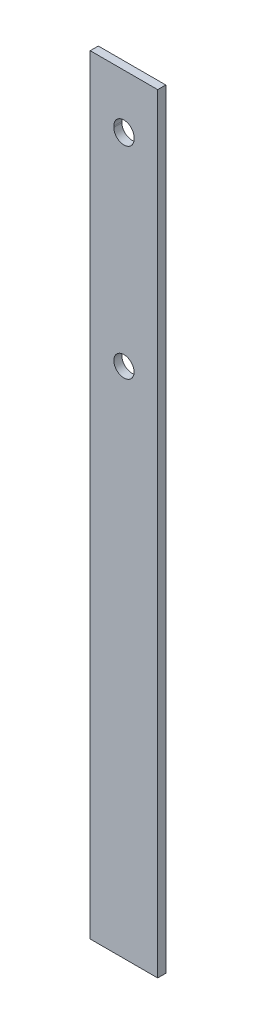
SolidWorks part; units mm, degrees
ref_plane "Front Plane" through (0, 0, 0) normal (0, 0, 1) x (1, 0, 0)
ref_plane "Top Plane" through (0, 0, 0) normal (0, 1, 0) x (1, 0, 0)
ref_plane "Right Plane" through (0, 0, 0) normal (1, 0, 0) x (0, 0, -1)
sketch "Sketch3" plane through (0, 0, 0) normal (0, 1, 0) x (0, 0, -1)
  line L8 (-3, 0) -> (3, 0) construction
  line L9 (3, 25) -> (-3, 25)
  line L10 (3, 25) -> (3, -25)
  line L11 (3, -25) -> (-3, -25)
  line L12 (-3, 25) -> (-3, -25)
  dimension "tjocklek" = 50
  dimension "bredd" = 6
extrude "Extrude höjd" add sketch "Sketch3" along normal up to vertex (370 mm away)
sketch "Sketch4" plane through (0, 0, 0) normal (0, 0, 1) x (1, 0, 0)
  line L0 (0, 0) -> (0, 330) construction
  line L2 (0, 330) -> (0, 370) construction
  line L3 (7.5, 329.5) -> (7.5, 330.5)
  line L4 (-7.5, 329.5) -> (-7.5, 330.5)
  line L7 (0, 329.5) -> (0, 330.5) construction
  arc A0 (7.5, 330.5) -> (-7.5, 330.5) centre (0, 330.5) ccw
  arc A1 (-7.5, 329.5) -> (7.5, 329.5) centre (0, 329.5) ccw
  circle A2 centre (0, 330) radius 6 construction
  circle A3 centre (0, 180) radius 6 construction
  circle A4 centre (0, 180) radius 7.5
  point P8 (0, 330)
  dimension "D3" = 15
  dimension "D4" = 16
  dimension "D2" = 12
  dimension "D1" = 150
  dimension "D6" = 40
  dimension "D5" = 15
  dimension "D7" = 180
extrude "Cut hål mot stolpe" cut sketch "Sketch4" against normal through all and the other way through all
sketch "Sketch5" plane through (0, 0, 0) normal (0, -1, 0) x (1, 0, 0)
  line L4 (-25, 3) -> (-25, -3)
  line L5 (25, 3) -> (-25, 3)
  line L6 (25, -3) -> (25, 3)
  line L7 (-25, -3) -> (25, -3)
  line L8 (-25, 3) -> (-25, -3)
  line L9 (25, 3) -> (-25, 3)
  line L10 (25, -3) -> (25, 3)
  line L11 (-25, -3) -> (25, -3)
  dimension "D1" = 0
extrude "Extrude förankringslängd" add sketch "Sketch5" along normal blind 200
sketch "Sketch7" plane through (0, 0, 0) normal (0, 1, 0) x (1, 0, 0)
  circle A0 centre (0, 0) radius 13.994
  dimension "D1" = 27.9881
extrude "Cut slits för förankringsstål" cut sketch "Sketch7" along normal blind 50
sketch "Sketch8" plane through (0, 0, 0) normal (0, 0, 1) x (1, 0, 0)
  line L0 (-40, 50) -> (40, 50)
  line L1 (-11.3137, 50) -> (11.3137, 50) construction
  line L2 (40, 450) -> (40, 0) construction
  line L3 (-40, 450) -> (-40, 0) construction
